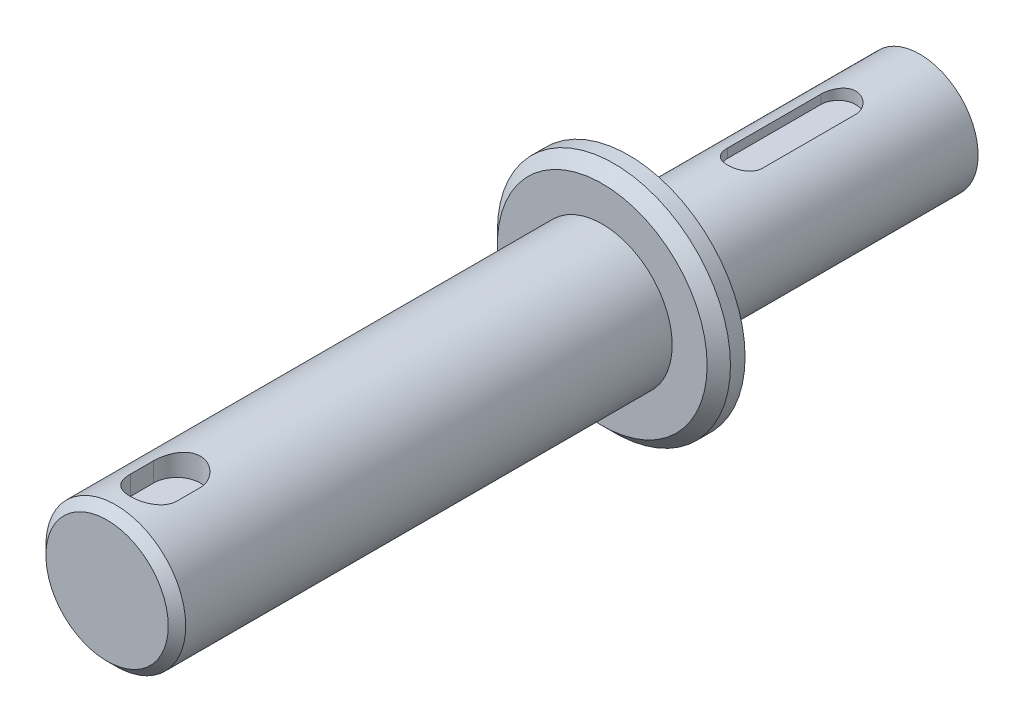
SolidWorks part; units mm, degrees
ref_plane "Plan1" through (0, 0, 0) normal (0, 0, 1) x (1, 0, 0)
ref_plane "Plan2" through (0, 0, 0) normal (0, 1, 0) x (1, 0, 0)
ref_plane "Plan3" through (0, 0, 0) normal (1, 0, 0) x (0, 0, -1)
sketch "Esquisse1" plane through (0, 0, 0) normal (0, 0, 1) x (1, 0, 0)
  circle A0 centre (0, 0) radius 20
  dimension "D1" = 40
extrude "Base-Extrusion" add sketch "Esquisse1" along normal blind 4.51
chamfer "Chanfrein1" distance 2 angle 45 1 edges at (20, 0, 4.51)
sketch "Esquisse2" plane through (0, 0, 4.51) normal (0, 0, 1) x (1, 0, 0)
  circle A0 centre (0, 0) radius 12
  dimension "D1" = 24
extrude "Boss.-Extru.1" add sketch "Esquisse2" along normal blind 85
chamfer "Chanfrein2" distance 1.5 angle 45 1 edges at (12, 0, 89.51)
ref_plane "Plan4" through (0, 8, 0) normal (0, 1, 0) x (-1, 0, 0)
sketch "Esquisse3" plane through (0, 8, 0) normal (0, 1, 0) x (1, 0, 0)
  line L0 (4, -77.51) -> (4, -81.51)
  line L1 (-4, -77.51) -> (-4, -81.51)
  line L2 (-10.5, -89.51) -> (10.5, -89.51) construction
  arc A0 (4, -77.51) -> (-4, -77.51) centre (0, -77.51) ccw
  arc A1 (-4, -81.51) -> (4, -81.51) centre (0, -81.51) ccw
  dimension "D1" = 4
  dimension "D2" = 4
  dimension "D3" = 8
extrude "Enlèv. mat.-Extru.1" cut sketch "Esquisse3" along normal through all
sketch "Esquisse4" plane through (0, 0, 0) normal (0, 0, -1) x (-1, 0, 0)
  circle A0 centre (0, 0) radius 10
  dimension "D1" = 20
extrude "Boss.-Extru.2" add sketch "Esquisse4" along normal blind 50
ref_plane "Plan5" through (0, 10, 0) normal (0, 1, 0) x (1, 0, 0)
sketch "Esquisse5" plane through (0, 10, 0) normal (0, 1, 0) x (1, 0, 0)
  line L0 (0, 20) -> (0, 36) construction
  line L1 (-3, 20) -> (-3, 36)
  line L2 (3, 20) -> (3, 36)
  line L3 (20, 0) -> (-20, 0) construction
  arc A0 (-3, 20) -> (3, 20) centre (0, 20) ccw
  arc A1 (3, 36) -> (-3, 36) centre (0, 36) ccw
  point P3 (0, 28)
  dimension "D1" = 3
  dimension "D3" = 20
  dimension "D2" = 16
extrude "Enlèv. mat.-Extru.2" cut sketch "Esquisse5" against normal blind 2
